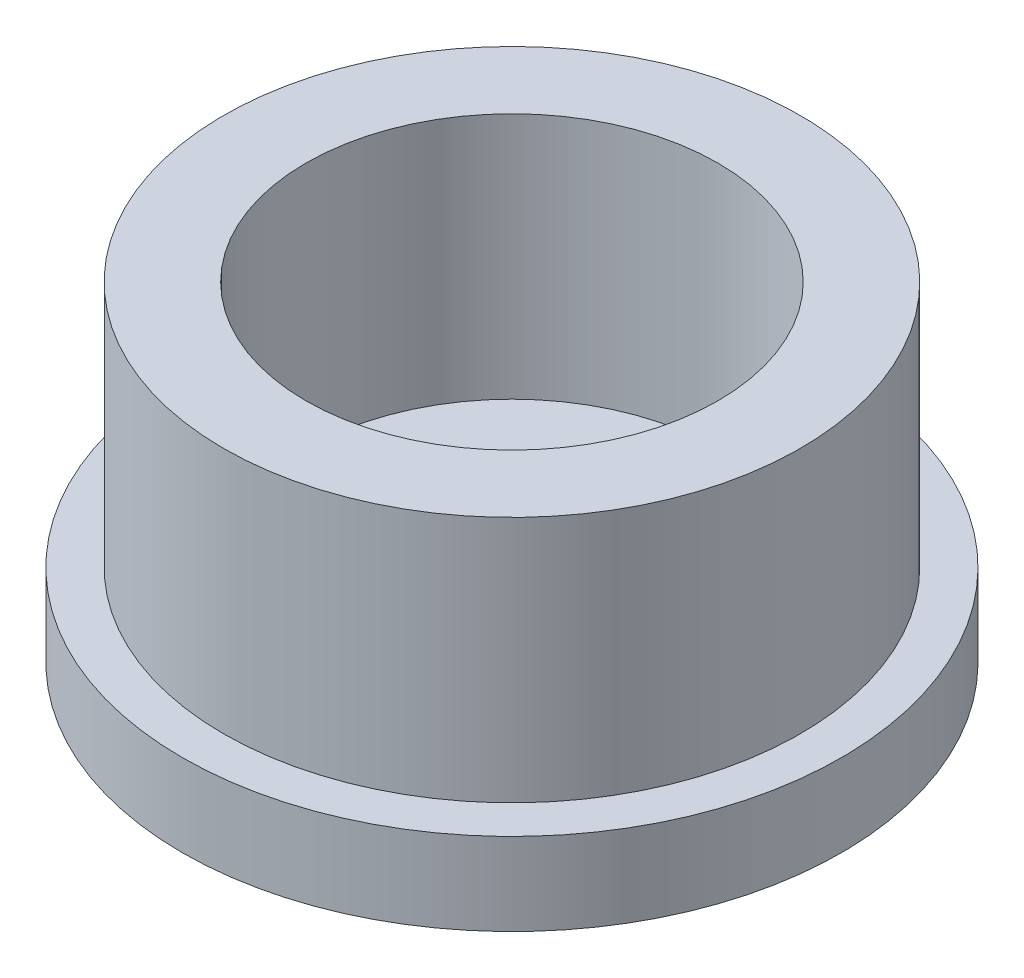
SolidWorks part; units mm, degrees
ref_plane "Front Plane" through (0, 0, 0) normal (0, 0, 1) x (1, 0, 0)
ref_plane "Top Plane" through (0, 0, 0) normal (0, 1, 0) x (1, 0, 0)
ref_plane "Right Plane" through (0, 0, 0) normal (1, 0, 0) x (0, 0, -1)
sketch "草图1" plane through (0, 0, 0) normal (0, 1, 0) x (1, 0, 0)
  circle A0 centre (0, 0) radius 4
extrude "凸台-拉伸1" add sketch "草图1" along normal blind 1
sketch "草图2" plane through (0, 1, 0) normal (0, 1, 0) x (1, 0, 0)
  circle A0 centre (0, 0) radius 1.1
extrude "切除-拉伸1" cut sketch "草图2" against normal blind 1
sketch "草图3" plane through (0, 1, 0) normal (0, 1, 0) x (1, 0, 0)
  circle A0 centre (0, 0) radius 2.5
  circle A2 centre (0, 0) radius 3.5
extrude "凸台-拉伸2" add sketch "草图3" along normal blind 3
